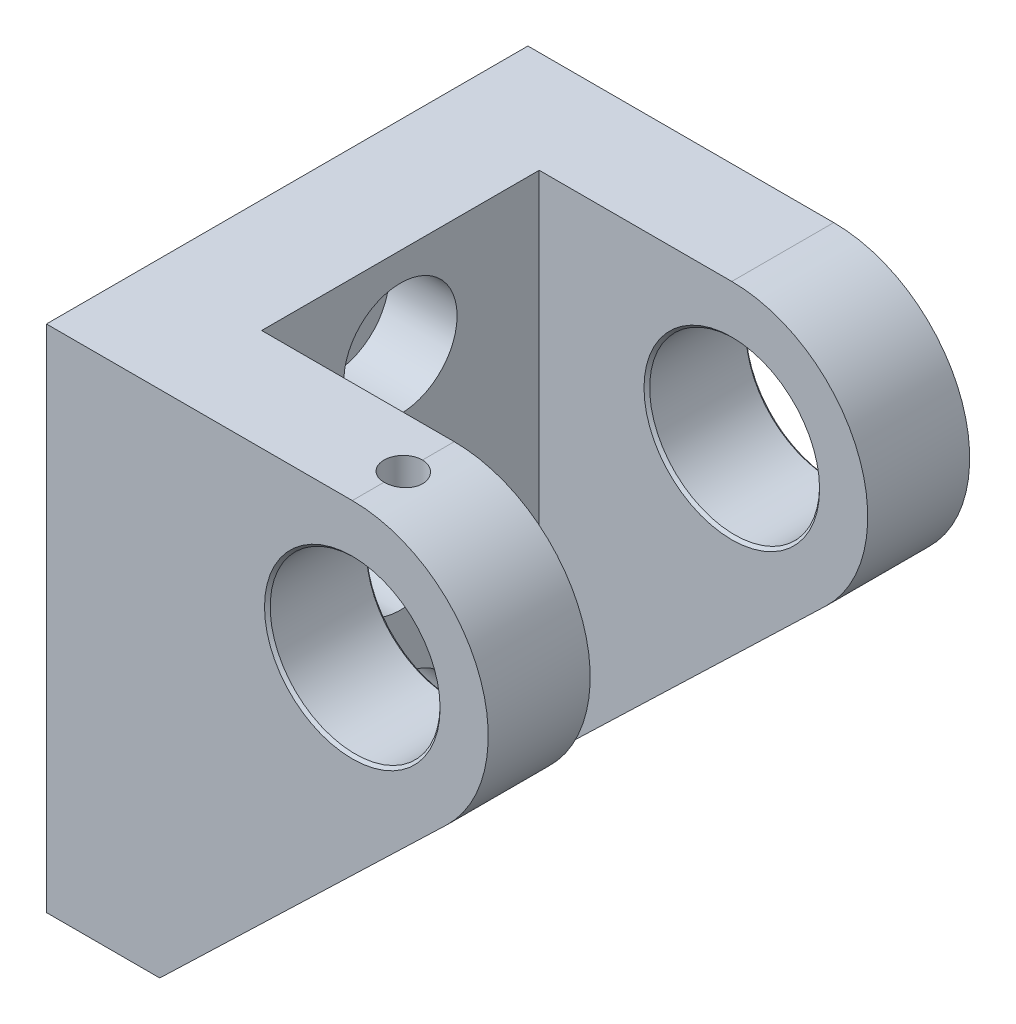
SolidWorks part; units mm, degrees
ref_plane "Piano frontale" through (0, 0, 0) normal (0, 0, 1) x (1, 0, 0)
ref_plane "Piano superiore" through (0, 0, 0) normal (0, 1, 0) x (1, 0, 0)
ref_plane "Piano destro" through (0, 0, 0) normal (1, 0, 0) x (0, 0, -1)
sketch "Schizzo1" plane through (0, 0, 0) normal (0, 0, 1) x (1, 0, 0)
  line L0 (0, 24) -> (-54, 24)
  line L1 (-54, 24) -> (-54, -66)
  line L2 (-54, -66) -> (-34, -66)
  line L3 (-34, -66) -> (16.6369, -17.2978)
  arc A0 (16.6369, -17.2978) -> (0, 24) centre (0, 0) ccw
  dimension "D1" = 48
  dimension "D2" = 54
  dimension "D3" = 20
  dimension "D4" = 90
extrude "Estrusione1" add sketch "Schizzo1" along normal mid plane 85
sketch "Schizzo4" plane through (0, 0, 0) normal (0, 0, 1) x (1, 0, 0)
  line L0 (0, 24) -> (-54, 24) construction
  line L1 (0, 24) -> (-34, 24)
  line L2 (-34, -66) -> (16.6369, -17.2978) construction
  line L3 (-34, -66) -> (16.6369, -17.2978)
  line L4 (-34, 24) -> (-34, -66)
  arc A0 (16.6369, -17.2978) -> (0, 24) centre (0, 0) ccw construction
  arc A1 (16.6369, -17.2978) -> (0, 24) centre (0, 0) ccw
extrude "Taglio-Estrusione1" cut sketch "Schizzo4" against normal mid plane 49
sketch "Schizzo5" plane through (0, 0, 42.5) normal (0, 0, 1) x (1, 0, 0)
  circle A0 centre (0, 0) radius 15
  dimension "D1" = 30
extrude "Taglio-Estrusione2" cut sketch "Schizzo5" against normal through all
hole_wizard "M12 Lamatura per vite a copertura cilindrica esagonale1" positions "Schizzo8" profile "Schizzo7" counterbore size "M12" standard "DIN"
sketch "Schizzo8" plane through (-34, 0, 0) normal (1, 0, 0) x (0, 0, -1)
  point P0 (0, 9)
  point P1 (0, -21)
  point P3 (0, -51)
  dimension "D1" = 9
  dimension "D2" = 30
  dimension "D3" = 30
sketch "Schizzo7" plane through (-34, 9, 0) normal (0, 1, 0) x (0, 0, -1)
  line L0 (0, 0) -> (0, 20)
  line L1 (0, 20) -> (6.5, 20)
  line L3 (6.5, 20) -> (6.5, 12)
  line L4 (6.5, 12) -> (10, 12)
  line L5 (10, 12) -> (10, 0)
  line L7 (10, 0) -> (0, 0)
  line L11 (0, -6.35) -> (0, 107.95) construction
  dimension "Thru Hole Dia." = 13
  dimension "Thru Hole Depth" = 20
  dimension "C'Bore Dia." = 20
  dimension "C'Bore Depth" = 12
hole_wizard "M8 Foro filettato profondo1" positions "Schizzo10" profile "Schizzo9" tap size "M8" standard "ISO"
sketch "Schizzo10" plane through (0, 24, 0) normal (0, 1, 0) x (-1, 0, 0)
  line L0 (0, 42.5) -> (54, 42.5) construction
  point P0 (0, 33.5)
  dimension "D1" = 9
sketch "Schizzo9" plane through (0, 24, 33.5) normal (1, 0, 0) x (0, 0, 1)
  line L0 (0, 0) -> (0, 9)
  line L1 (0, 9) -> (3.4, 9)
  line L2 (3.4, 9) -> (3.4, 0)
  line L5 (3.4, 0) -> (0, 0)
  line L11 (0, -6.35) -> (0, 107.95) construction
  dimension "Thru Tap Drill Dia." = 6.8
  dimension "Thru Tap Drill Depth" = 9
hole_wizard "Ø8.0 (8) Foro diametrale1" positions "Schizzo12" profile "Schizzo11" hole size "Ø8.0" standard "ISO"
sketch "Schizzo12" plane through (-34, 0, 0) normal (1, 0, 0) x (0, 0, -1)
  point P0 (-15, -58)
  dimension "D1" = 15
  dimension "D2" = 58
sketch "Schizzo11" plane through (-34, -58, 15) normal (0, 1, 0) x (0, 0, -1)
  line L0 (0, 0) -> (0, 20)
  line L1 (0, 20) -> (4, 20)
  line L2 (4, 20) -> (4, 0)
  line L5 (4, 0) -> (0, 0)
  line L11 (0, -6.35) -> (0, 107.95) construction
  dimension "Thru Hole Dia." = 8
  dimension "Thru Hole Depth" = 20
chamfer "Smusso1" distance 0.5 angle 45 4 edges at (15, 0, 24.5) (15, 0, 42.5) (15, 0, -24.5) (15, 0, -42.5)
